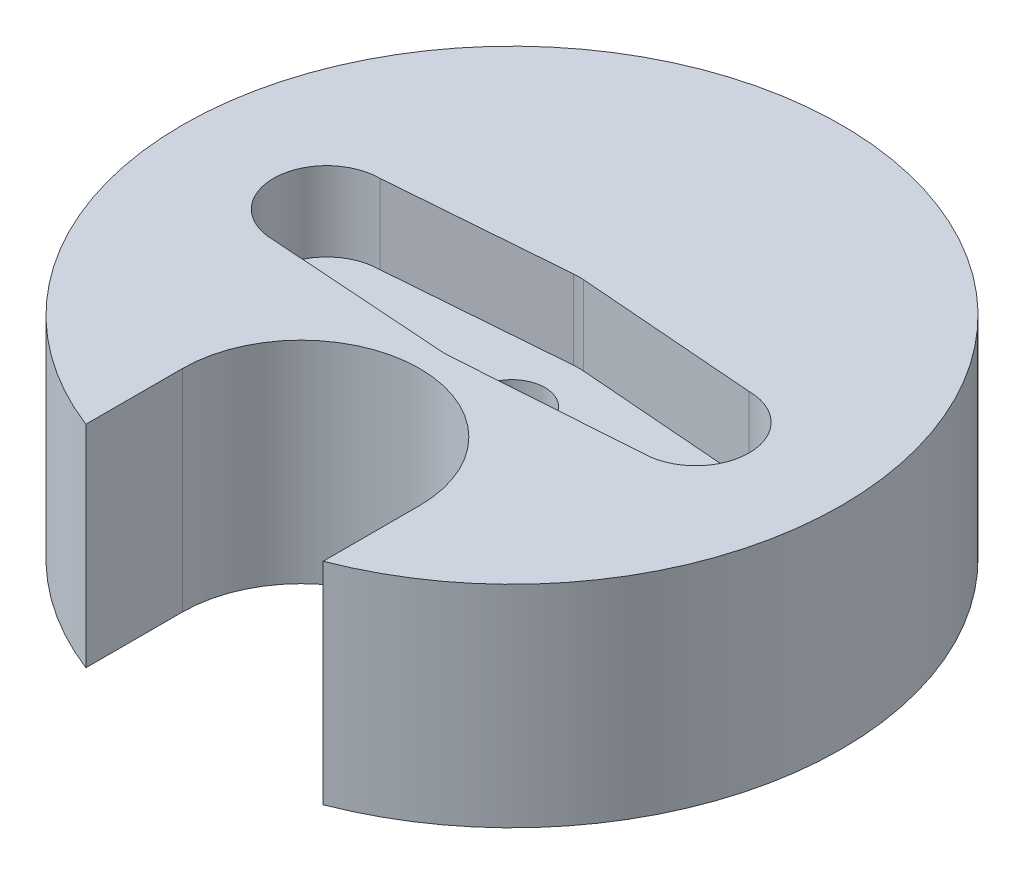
SolidWorks part; units mm, degrees
ref_plane "Ön Düzlem" through (0, 0, 0) normal (0, 0, 1) x (1, 0, 0)
ref_plane "Üst Düzlem" through (0, 0, 0) normal (0, 1, 0) x (1, 0, 0)
ref_plane "Sağ Düzlem" through (0, 0, 0) normal (1, 0, 0) x (0, 0, -1)
sketch "Çizim1" plane through (0, 0, 0) normal (0, 1, 0) x (1, 0, 0)
  line L0 (-4.5, -8) -> (-4.5, -11.6619)
  line L1 (4.5, -8) -> (4.5, -11.6619)
  arc A0 (4.5, -11.6619) -> (-4.5, -11.6619) centre (0, 0) ccw
  arc A1 (4.5, -8) -> (-4.5, -8) centre (0, -8) ccw
  dimension "D1" = 25
  dimension "D2" = 9
extrude "Yükseklik-Ekstrüzyon1" add sketch "Çizim1" along normal blind 5
sketch "Çizim2" plane through (0, 0, 0) normal (0, 1, 0) x (1, 0, 0)
  circle A0 centre (0, 0) radius 2.5
  dimension "D1" = 5
extrude "Kes-Ekstrüzyon3" cut sketch "Çizim2" along normal blind 2.5
sketch "Çizim3" plane through (0, 2.5, 0) normal (0, -1, 0) x (1, 0, 0)
  circle A0 centre (0, 0) radius 1.25
extrude "Kes-Ekstrüzyon4" cut sketch "Çizim3" against normal through all
sketch "Çizim5" plane through (0, 5, 0) normal (0, 1, 0) x (1, 0, 0)
  circle A3 centre (-6.45, -0.0087) radius 0.6
  circle A4 centre (6.45, 0.0087) radius 0.6
extrude "Kes-Ekstrüzyon5" cut sketch "Çizim5" against normal blind 2.5
sketch "Çizim6" plane through (0, 5, 0) normal (0, 1, 0) x (1, 0, 0)
  line L0 (-7, 1.9913) -> (-0.1973, 2.5233)
  line L1 (-7, -2.0518) -> (-0.175, -2.525)
  line L2 (0, -2.75) -> (0, 2.75) construction
  line L3 (7, -2.0518) -> (0.175, -2.525)
  line L4 (7, 1.9913) -> (0.1973, 2.5233)
  line L5 (-4.5, -8) -> (-4.5, -11.6619)
  line L6 (4.5, -8) -> (4.5, -11.6619)
  arc A0 (0.1973, 2.5233) -> (-0.1973, 2.5233) centre (0, 0) ccw
  arc A1 (-7, 1.9913) -> (-7, -2.0518) centre (-7, -0.0303) ccw
  arc A2 (-0.175, -2.525) -> (0.175, -2.525) centre (0, 0) ccw
  arc A3 (7, 1.9913) -> (7, -2.0518) centre (7, -0.0303) cw
  arc A4 (4.5, -11.6619) -> (-4.5, -11.6619) centre (0, 0) ccw
  arc A5 (4.5, -8) -> (-4.5, -8) centre (0, -8) ccw
  point P9 (0, 0)
  point P12 (0, 0)
  point P16 (0, 0)
  point P18 (0, 0)
  dimension "D1" = 7
extrude "Yükseklik-Ekstrüzyon3" add sketch "Çizim6" along normal blind 3 contours L4 A3 L3 A2 L1 A1 L0 A0 M7 M4 M5 M6
